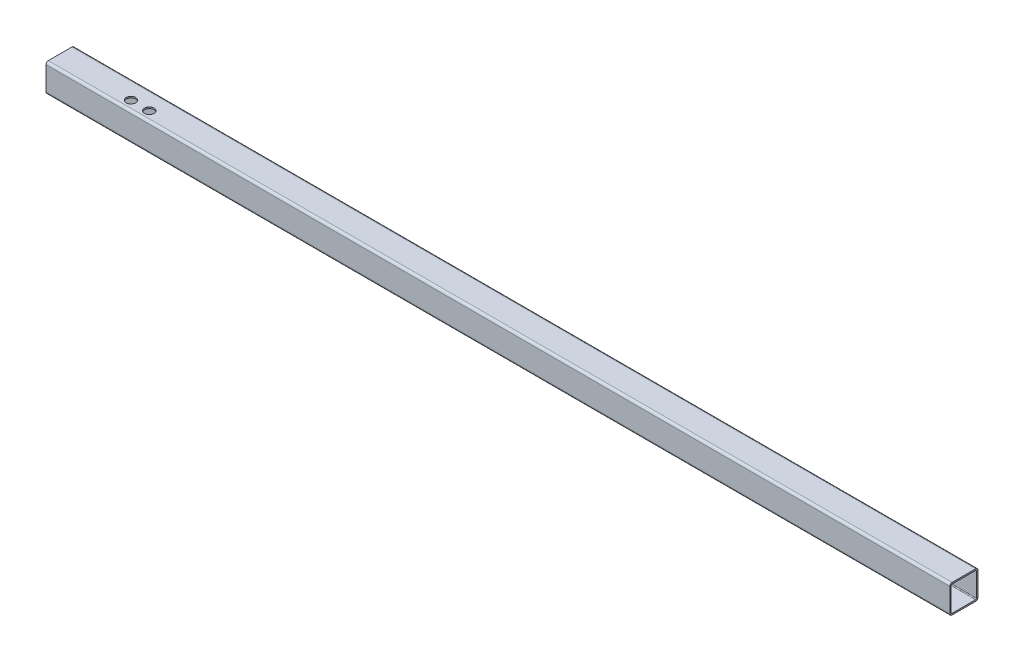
SolidWorks part; units mm, degrees
ref_plane "Front Plane" through (0, 0, 0) normal (0, 0, 1) x (1, 0, 0)
ref_plane "Top Plane" through (0, 0, 0) normal (0, 1, 0) x (1, 0, 0)
ref_plane "Right Plane" through (0, 0, 0) normal (1, 0, 0) x (0, 0, -1)
sketch "Sketch1" plane through (0, 0, 0) normal (1, 0, 0) x (0, 0, -1)
  line L0 (-0.1864, 2.5839) -> (-0.1864, 29.1661)
  line L1 (-2.7702, 31.75) -> (-29.3525, 31.75)
  line L2 (-31.9364, 29.1661) -> (-31.9364, 2.5839)
  line L3 (-29.3525, 0) -> (-2.7702, 0)
  line L12 (-1.8374, 2.54) -> (-1.8374, 29.2085)
  line L13 (-2.7279, 30.099) -> (-29.3964, 30.099)
  line L14 (-30.2854, 29.21) -> (-30.2854, 2.5415)
  line L15 (-29.3964, 1.651) -> (-2.7279, 1.651)
  arc A0 (-31.9364, 2.5839) -> (-29.3525, 0) centre (-29.3525, 2.5839) ccw
  arc A1 (-0.1864, 2.5839) -> (-2.7702, 0) centre (-2.7702, 2.5839) cw
  arc A2 (-0.1864, 29.1661) -> (-2.7702, 31.75) centre (-2.7702, 29.1661) ccw
  arc A3 (-31.9364, 29.1661) -> (-29.3525, 31.75) centre (-29.3525, 29.1661) cw
  arc A16 (-1.8374, 2.54) -> (-2.7279, 1.651) centre (-2.7264, 2.54) cw
  arc A17 (-29.3964, 1.651) -> (-30.2854, 2.5415) centre (-29.3964, 2.54) cw
  arc A18 (-1.8374, 29.2085) -> (-2.7279, 30.099) centre (-2.7264, 29.21) ccw
  arc A19 (-30.2854, 29.21) -> (-29.3964, 30.099) centre (-29.3964, 29.21) cw
  point P12 (0, 0)
  point P15 (0, 31.6215)
  point P18 (-31.75, 31.6215)
  point P23 (-30.2854, 1.651)
extrude "Boss-Extrude1" add sketch "Sketch1" along normal blind 609.6
scale "Scale1" bodies to scale 101 scale about centroid uniform scaling no x scale factor 1 y scale factor 0.6 z scale factor 0.6
sketch "Sketch2" plane through (0, 25.4, 0) normal (0, 1, 0) x (1, 0, 0)
  line L0 (0, -8.0867) -> (0, -24.036) construction
  line L1 (609.6, -24.036) -> (0, -24.036) construction
  circle A0 centre (50.9509, -19.2364) radius 3.175
  circle A1 centre (63.3491, -19.2364) radius 3.175
  dimension "D1" = 6.35
  dimension "D2" = 50.9509
  dimension "D3" = 63.3491
  dimension "D4" = 4.7997
extrude "Cut-Extrude1" cut sketch "Sketch2" against normal blind 2.54
equation "\"BeamTickness\"= 0.065in"
equation "\"D1@Sketch1\"=\"BeamTickness\""
equation "\"D2@Sketch1\"=\"BeamTickness\""
equation "\"D3@Sketch1\"=\"BeamTickness\""
equation "\"D4@Sketch1\"=\"BeamTickness\""
